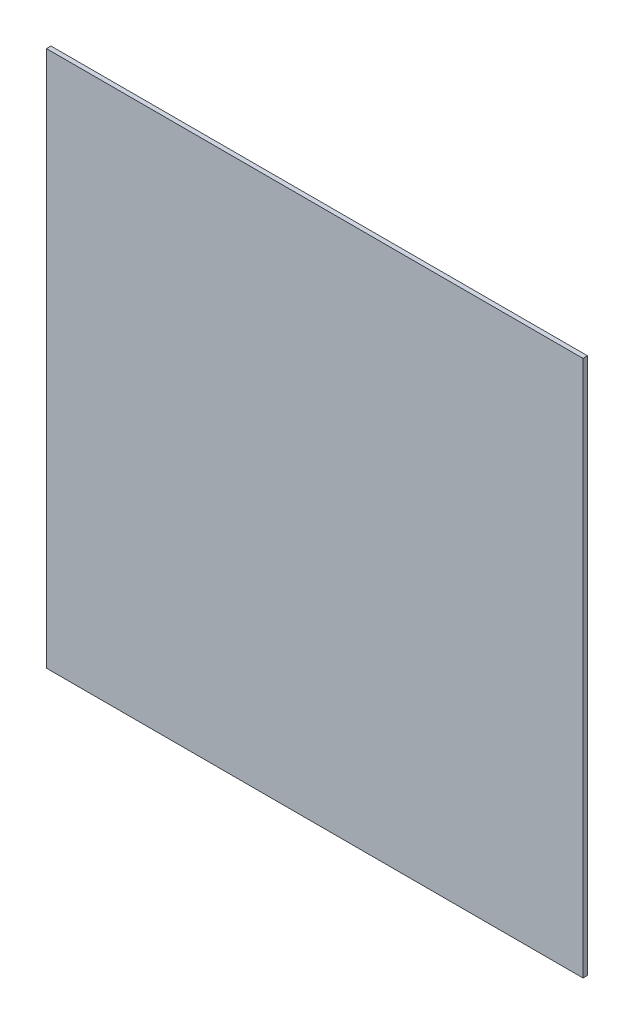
SolidWorks part; units mm, degrees
ref_plane "Front Plane" through (0, 0, 0) normal (0, 0, 1) x (1, 0, 0)
ref_plane "Top Plane" through (0, 0, 0) normal (0, 1, 0) x (1, 0, 0)
ref_plane "Right Plane" through (0, 0, 0) normal (1, 0, 0) x (0, 0, -1)
sketch "Sketch1" plane through (0, 0, 0) normal (0, 0, 1) x (1, 0, 0)
  line L0 (-305, -305) -> (-305, 290) construction
  line L1 (-305, 290) -> (290, 290) construction
  line L2 (290, 290) -> (290, -305) construction
  line L3 (290, -305) -> (-305, -305) construction
  line L4 (-305, -305) -> (-305, 290)
  line L5 (-305, 290) -> (290, 290)
  line L6 (290, 290) -> (290, -305)
  line L7 (290, -305) -> (-305, -305)
extrude "Boss-Extrude1" add sketch "Sketch1" along normal blind 5
